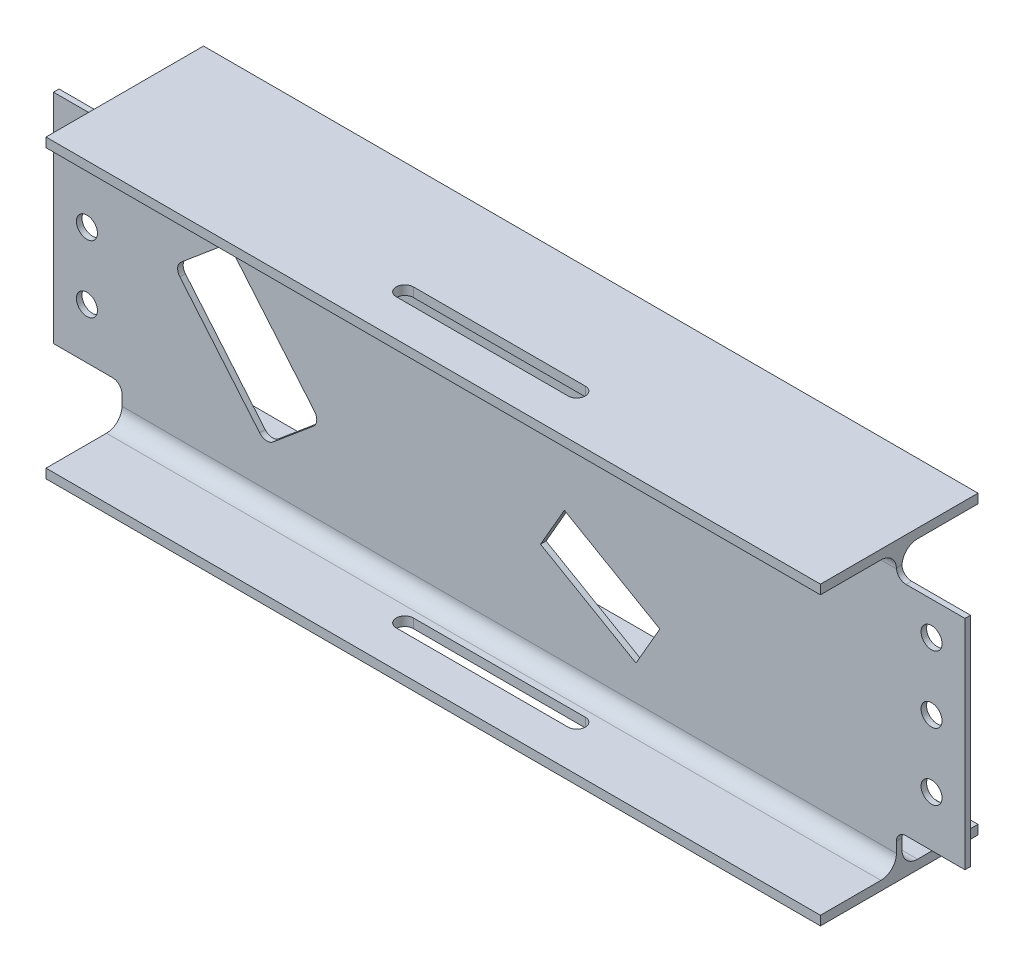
SolidWorks part; units mm, degrees
ref_plane "Front Plane" through (0, 0, 0) normal (0, 0, 1) x (1, 0, 0)
ref_plane "Top Plane" through (0, 0, 0) normal (0, 1, 0) x (1, 0, 0)
ref_plane "Right Plane" through (0, 0, 0) normal (1, 0, 0) x (0, 0, -1)
sketch "Member Sketch" plane through (0, 0, 0) normal (0, 1, 0) x (1, 0, 0)
  line L0 (0, 0) -> (1000, 0)
  line L2 (0, 0) -> (1000, 0) construction
other "Structural Member1"
ref_plane "Plane1" through (0, 0, 0) normal (1, 0, 0) x (0, 0, -1)
sketch "Sketch1" plane through (0, -155, 0) normal (1, 0, 0) x (0, 0, -1)
  line L0 (-82.5, 155) -> (82.5, 155)
  line L1 (82.5, 155) -> (82.5, 145.3)
  line L2 (82.5, 145.3) -> (19.2, 145.3)
  line L3 (2.9, 129) -> (2.9, -129)
  line L4 (-2.9, 0) -> (2.9, 0) construction
  line L5 (0, -155) -> (0, 155) construction
  line L6 (-2.9, 129) -> (-2.9, -129)
  line L7 (-82.5, 145.3) -> (-19.2, 145.3)
  line L8 (-82.5, 155) -> (-82.5, 145.3)
  line L9 (-82.5, -155) -> (-82.5, -145.3)
  line L10 (-82.5, -145.3) -> (-19.2, -145.3)
  line L11 (82.5, -145.3) -> (19.2, -145.3)
  line L12 (82.5, -155) -> (82.5, -145.3)
  line L13 (-82.5, -155) -> (82.5, -155)
  line L14 (-82.5, 145.3) -> (-82.5, -145.3) construction
  line L15 (82.5, 145.3) -> (82.5, -145.3) construction
  line L16 (-2.9, 0) -> (-82.5, 0) construction
  line L17 (2.9, 0) -> (82.5, 0) construction
  arc A0 (19.2, 145.3) -> (2.9, 129) centre (19.2, 129) ccw
  arc A3 (-19.2, 145.3) -> (-2.9, 129) centre (-19.2, 129) cw
  arc A4 (-19.2, -145.3) -> (-2.9, -129) centre (-19.2, -129) ccw
  arc A7 (19.2, -145.3) -> (2.9, -129) centre (19.2, -129) cw
  point P18 (0, 0)
  dimension "Root Radius(r)" = 16.3
  dimension "Section Depth(D)" = 310
  dimension "Flange Width(B)" = 165
  dimension "Flange Thickness(T)" = 9.7
  dimension "Web Thickness(W)" = 5.8
  dimension "FlangeWebToe(K)" = 26
sketch "Sketch2" plane through (0, 0, 0) normal (0, 1, 0) x (1, 0, 0)
  line L0 (500, 0) -> (1500, 0) construction
  line L1 (0, -90.75) -> (0, 90.75) construction
  line L2 (-170.5, 0) -> (170.5, 0) construction
  text T0 "W310x39" font "Century Gothic" height 30
  dimension "D1" = 500
  dimension "D2" = 1000
extrude "MARKING" [suppressed] cut sketch "Sketch2" against normal blind 1
other "0008-AABE004-CN02-FP01D01-1 - MEMBER2 CAVITY"
other "0008-AABE004<1>@0008-AA/0008-AABE004-CN02-FP01<1>@0008-AABE004/0008-AABE004-CN02-FP01D01<1>@0008-AABE004-CN02-FP011"
other "0008-AABE004-CN02-FP01D02-1 - MEMBER2 CAVITY"
other "0008-AABE004<1>@0008-AA/0008-AABE004-CN02-FP01<1>@0008-AABE004/0008-AABE004-CN02-FP01D02<1>@0008-AABE004-CN02-FP011"
other "0008-AABE002-CN01-FP02D01-1 - MEMBER2 CAVITY"
other "0008-AABE002<1>@0008-AA/0008-AABE002-CN01-FP02<1>@0008-AABE002/0008-AABE002-CN01-FP02D01<1>@0008-AABE002-CN01-FP021"
other "0008-AABE002-CN01-FP02D02-1 - MEMBER2 CAVITY"
other "0008-AABE002<1>@0008-AA/0008-AABE002-CN01-FP02<1>@0008-AABE002/0008-AABE002-CN01-FP02D02<1>@0008-AABE002-CN01-FP021"
sketch "Sketch12" plane through (0, 0, -2.9) normal (0, 0, -1) x (-1, 0, 0)
  line L0 (-657.75, -204.4338) -> (-557.75, -146.6987)
  line L1 (-657.75, -204.4338) -> (-632.75, -247.735)
  line L2 (-557.75, -146.6987) -> (-532.75, -190)
  line L3 (-632.75, -247.735) -> (-532.75, -190)
  line L4 (-22.75, -263) -> (-22.75, -35) construction
  line L5 (-905.5, -310) -> (-94.5, -310) construction
  line L6 (-905.5, 0) -> (-94.5, 0) construction
  line L7 (-296.1053, -187.8046) -> (-212.5429, -88.2188)
  line L8 (-294.8727, -201.8929) -> (-252.7403, -237.2462)
  line L9 (-198.4546, -86.9862) -> (-156.3221, -122.3396)
  line L10 (-238.6519, -236.0137) -> (-155.0896, -136.4279)
  arc A0 (-238.6519, -236.0137) -> (-252.7403, -237.2462) centre (-246.3124, -229.5858) cw
  arc A1 (-294.8727, -201.8929) -> (-296.1053, -187.8046) centre (-288.4448, -194.2325) cw
  arc A2 (-198.4546, -86.9862) -> (-212.5429, -88.2188) centre (-204.8824, -94.6467) ccw
  arc A3 (-156.3221, -122.3396) -> (-155.0896, -136.4279) centre (-162.75, -130) cw
  dimension "D6" = 10
  dimension "D1" = 510
  dimension "D2" = 100
  dimension "D3" = 30
  dimension "D4" = 50
  dimension "D5" = 190
  dimension "D7" = 140
  dimension "D8" = 50
  dimension "D9" = 130
  dimension "D10" = 75
  dimension "D11" = 150
extrude "Cut-Extrude1" cut sketch "Sketch12" against normal through all
sketch "Sketch13" plane through (0, 0, 0) normal (0, 1, 0) x (1, 0, 0)
  line L0 (422.75, -35) -> (602.75, -35) construction
  line L1 (422.75, -26) -> (602.75, -26)
  line L2 (422.75, -44) -> (602.75, -44)
  line L3 (-170.5, 0) -> (170.5, 0) construction
  arc A0 (422.75, -26) -> (422.75, -44) centre (422.75, -35) ccw
  arc A1 (602.75, -44) -> (602.75, -26) centre (602.75, -35) ccw
  point P2 (512.75, -35)
  dimension "D1" = 18
  dimension "D2" = 180
  dimension "D3" = 400
  dimension "D4" = 35
extrude "Cut-Extrude2" cut sketch "Sketch13" against normal through all
